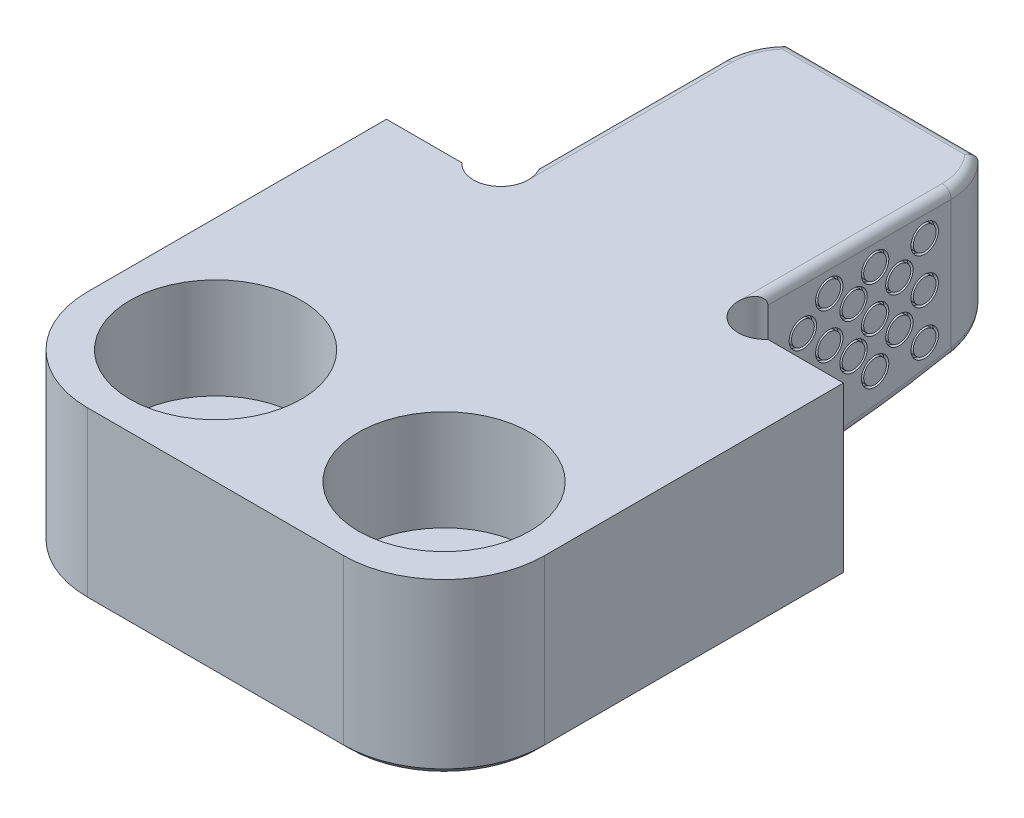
SolidWorks part; units mm, degrees
ref_plane "Front Plane" through (0, 0, 0) normal (0, 0, 1) x (1, 0, 0)
ref_plane "Top Plane" through (0, 0, 0) normal (0, 1, 0) x (1, 0, 0)
ref_plane "Right Plane" through (0, 0, 0) normal (1, 0, 0) x (0, 0, -1)
sketch "Sketch1" plane through (0, 0, 0) normal (0, 1, 0) x (1, 0, 0)
  line L0 (-12.7, -22.1996) -> (12.7, -22.1996)
  line L6 (-6.3475, 0) -> (-6.3475, 14.8844)
  line L7 (-6.3475, 14.8844) -> (6.3475, 14.8844)
  line L8 (6.3475, 14.8844) -> (6.3475, 0)
  line L9 (6.3475, 0) -> (12.7, 0)
  line L10 (12.7, 0) -> (12.7, -22.1996)
  line L12 (0, 0) -> (0, 50000) construction
  line L13 (0, 0) -> (-50000, 0) construction
  line L21 (-12.7, 0) -> (-12.7, -22.1996)
  line L22 (-6.3475, 0) -> (-12.7, 0)
  dimension "D1" = 12.6949
  dimension "D2" = 22.1996
  dimension "D3" = 37.084
  dimension "D4" = 25.4
extrude "Boss-Extrude1" add sketch "Sketch1" against normal blind 9.4996 separate body
sketch "Sketch2" plane through (0, 0, 0) normal (0, 1, 0) x (1, 0, 0)
  line L0 (0, 0) -> (50000, 0) construction
  line L1 (0, 0) -> (0, 50000) construction
  line L4 (-6.3475, 14.8844) -> (-6.3475, 0) construction
  line L5 (6.3475, 14.8844) -> (-6.3475, 14.8844) construction
  line L12 (6.3475, 8.5344) -> (6.3475, 12.3444)
  line L13 (6.3475, 8.5344) -> (12.7, 8.5344)
  line L14 (12.7, 8.5344) -> (12.7, 21.2344)
  line L15 (-12.7, 21.2344) -> (12.7, 21.2344)
  line L16 (-12.7, 8.5344) -> (-12.7, 21.2344)
  line L17 (-6.3475, 8.5344) -> (-12.7, 8.5344)
  line L18 (-6.3475, 8.5344) -> (-6.3475, 12.3444)
  line L19 (-5.2951, 14.8844) -> (5.2951, 14.8844)
  arc A0 (6.3475, 12.3444) -> (6.0174, 14.3649) centre (-0.0025, 12.3444) ccw construction
  arc A1 (6.0174, 14.3649) -> (5.2951, 14.8844) centre (5.2951, 14.1224) ccw construction
  arc A2 (6.3475, 12.3444) -> (5.2951, 14.8844) centre (2.7561, 12.3444) ccw
  arc A6 (-6.0174, 14.3649) -> (-5.2951, 14.8844) centre (-5.2951, 14.1224) cw construction
  arc A7 (-6.3475, 12.3444) -> (-6.0174, 14.3649) centre (0.0025, 12.3444) cw construction
  arc A8 (-6.3475, 12.3444) -> (-5.2951, 14.8844) centre (-2.7561, 12.3444) cw
  dimension "D1" = 6.35
  dimension "D3" = 25.4
  dimension "D4" = 0.762
  dimension "D5" = 6.35
  dimension "D6" = 2.54
  dimension "D2" = 12.7
extrude "Cut-Extrude1" cut sketch "Sketch2" against normal through all
sketch "Sketch3" plane through (0, 0, 0) normal (0, 1, 0) x (1, 0, 0)
  line L0 (0, 0) -> (0, 50000) construction
  line L1 (0, 0) -> (50000, 0) construction
  line L6 (12.7, -0.508) -> (6.3475, -0.508)
  line L7 (12.7, -0.508) -> (6.3475, -0.508) construction
  line L9 (5.8395, 0) -> (5.8395, 12.3444)
  line L10 (5.8395, 0) -> (5.8395, 12.3444) construction
  circle A0 centre (7.3635, 1.016) radius 1.524
  circle A1 centre (-7.3635, 1.016) radius 1.524
  dimension "D1" = 1.524
  dimension "D2" = 0.508
  dimension "D3" = 0.508
extrude "Cut-Extrude2" cut sketch "Sketch3" against normal through all
sketch "Sketch5" plane through (12.7, 0, 0) normal (1, 0, 0) x (0, 0, -1)
  line L0 (-63.088, -9.2456) -> (49936.912, -9.2456) construction
  line L1 (-22.1996, -9.4996) -> (0, -9.4996) construction
  line L2 (14.8844, -9.4996) -> (14.8844, 0) construction
  line L3 (0, 9.7237) -> (0, -49990.2763) construction
  line L4 (0, -9.4996) -> (0, 0) construction
  line L5 (-11.0998, 0) -> (-11.0998, 50000) construction
  line L6 (-22.1996, 0) -> (0, 0) construction
  line L7 (0, -9.2456) -> (0, -19.6356)
  line L8 (0, -9.2456) -> (0.6604, -9.2456)
  line L9 (50.8, 15.2894) -> (50.8, -19.6356)
  line L10 (50.8, -19.6356) -> (0, -19.6356)
  arc A0 (0.6604, -9.2456) -> (50.8, 15.2894) centre (0.6604, 54.2544) ccw
  point P16 (-11.0998, 0)
  dimension "D2" = 63.5
  dimension "D3" = 14.224
  dimension "D1" = 0.254
  dimension "D4" = 34.925
  dimension "D5" = 50.8
extrude "Cut-Extrude3" cut sketch "Sketch5" against normal through all
fillet "Fillet1" radius 5.588 2 edges at (-12.7, -4.7498, 22.1996) (12.7, -4.7498, 22.1996)
fillet "Fillet2" radius 0.508 10 edges at (-6.0006, -7.8534, -13.8843) (6.1378, -7.9229, -13.5536) (6.3475, 0, -7.2482) (-6.0739, 0, -13.7191) (0, -7.632, -14.8844) (-6.3475, -8.9007, -7.2697) (6.3475, -8.9007, -7.2697) (6.0739, 0, -13.7191) (0, 0, -14.8844) (-6.3475, 0, -7.2482)
chamfer "Chamfer1" distance 0.381 angle 45 5 edges at (-12.7, -9.4996, 8.3058) (-11.0633, -9.4996, 20.5629) (0, -9.4996, 22.1996) (11.0633, -9.4996, 20.5629) (12.7, -9.4996, 8.3058)
hole_wizard "#10 CBORE" positions "Sketch7" profile "Sketch6" counterbore size "#10" standard "Ansi Inch"
sketch "Sketch7" plane through (0, 0, 0) normal (0, 1, 0) x (-1, 0, 0)
  line L0 (0, 0) -> (0, 50000) construction
  line L1 (0, 0) -> (50000, 0) construction
  line L2 (12.7, 0) -> (12.7, 16.6116) construction
  line L3 (7.112, 22.1996) -> (-7.112, 22.1996) construction
  point P0 (6.35, 15.8496)
  point P16 (-6.35, 15.8496)
  dimension "D1" = 6.35
  dimension "D2" = 6.35
sketch "Sketch6" plane through (-6.35, 0, 15.8496) normal (1, 0, 0) x (0, 0, 1)
  line L0 (0, 0) -> (0, 9.4996)
  line L1 (0, 9.4996) -> (2.5527, 9.4996)
  line L3 (2.5527, 9.4996) -> (2.5527, 5.588)
  line L4 (2.5527, 5.588) -> (4.7625, 5.588)
  line L5 (4.7625, 5.588) -> (4.7625, 0)
  line L7 (4.7625, 0) -> (0, 0)
  line L11 (0, -6.35) -> (0, 107.95) construction
  dimension "Thru Hole Dia." = 5.1054
  dimension "Thru Hole Depth" = 9.4996
  dimension "C'Bore Dia." = 9.525
  dimension "C'Bore Depth" = 5.588
sketch "Sketch8" plane through (6.3475, 0, 0) normal (1, 0, 0) x (0, 0, -1)
  circle A2 centre (9.4605, -2.8289) radius 0.762
  circle A3 centre (9.4605, -2.8289) radius 0.635
  circle A4 centre (9.4605, -5.3457) radius 0.762
  circle A5 centre (9.4605, -5.3457) radius 0.635
  circle A6 centre (10.8687, -1.6466) radius 0.762
  circle A7 centre (10.8687, -1.6466) radius 0.635
  circle A8 centre (10.8687, -4.1472) radius 0.762
  circle A9 centre (10.8687, -4.1472) radius 0.635
  circle A10 centre (10.8687, -6.664) radius 0.762
  circle A11 centre (10.8687, -6.664) radius 0.635
  circle A16 centre (8.1122, -1.6466) radius 0.762
  circle A17 centre (8.1122, -1.6466) radius 0.635
  circle A18 centre (8.1122, -4.1472) radius 0.762
  circle A19 centre (8.1122, -4.1472) radius 0.635
  circle A20 centre (8.1122, -6.664) radius 0.762
  circle A21 centre (8.1122, -6.664) radius 0.635
  circle A26 centre (6.9137, -2.8289) radius 0.762
  circle A27 centre (6.9137, -2.8289) radius 0.635
  circle A28 centre (6.9137, -5.3457) radius 0.762
  circle A29 centre (6.9137, -5.3457) radius 0.635
  circle A32 centre (5.5654, -1.6466) radius 0.762
  circle A33 centre (5.5654, -1.6466) radius 0.635
  circle A34 centre (5.5654, -4.1472) radius 0.762
  circle A35 centre (5.5654, -4.1472) radius 0.635
  circle A36 centre (5.5654, -6.664) radius 0.762
  circle A37 centre (5.5654, -6.664) radius 0.635
  circle A42 centre (4.0973, -2.8289) radius 0.762
  circle A43 centre (4.0973, -2.8289) radius 0.635
  circle A44 centre (4.0973, -5.3457) radius 0.762
  circle A45 centre (4.0973, -5.3457) radius 0.635
  dimension "D1" = 1.524
  dimension "D2" = 1.27
extrude "Cut-Extrude4" cut sketch "Sketch8" against normal blind 0.254
mirror "Mirror1" about plane through (0, 0, 0) normal (1, 0, 0) of "Cut-Extrude4"
